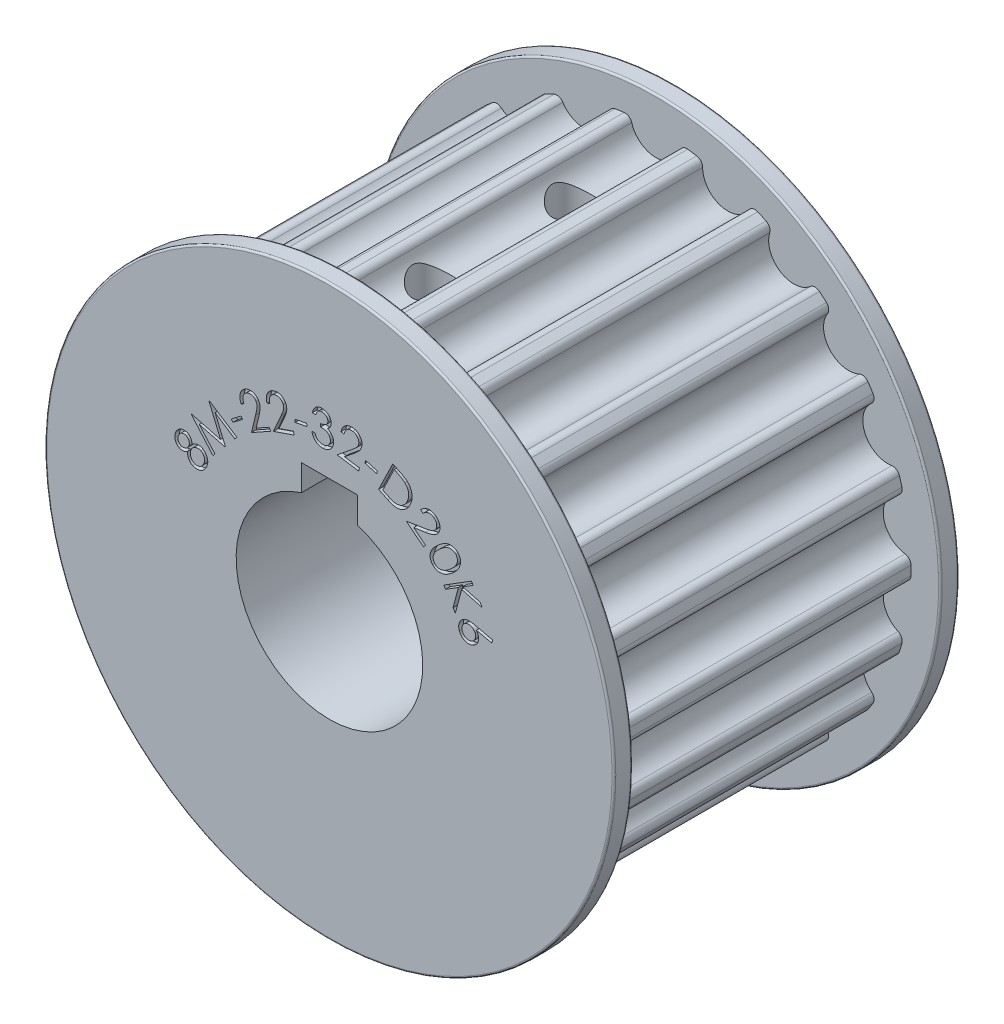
SolidWorks part; units mm, degrees
other "M5 Tapped Hole1[1]"
ref_plane "Front Plane" through (0, 0, 0) normal (0, 0, 1) x (1, 0, 0)
ref_plane "Top Plane" through (0, 0, 0) normal (0, 1, 0) x (1, 0, 0)
ref_plane "Right Plane" through (0, 0, 0) normal (1, 0, 0) x (0, 0, -1)
imported_body "Imported1"
sketch "Sketch1" plane through (0, 0, 37.5) normal (0, 0, 1) x (1, 0, 0)
  circle A0 centre (0, 0) radius 30.5
extrude "Cut-Extrude1" cut sketch "Sketch1" against normal blind 1.5
sketch "Sketch2" plane through (0, 0, -2.5) normal (0, 0, -1) x (-1, 0, 0)
  circle A0 centre (0, 0) radius 30.5
extrude "Cut-Extrude2" cut sketch "Sketch2" against normal blind 1.5
sketch "Sketch3" plane through (0, 0, 36) normal (0, 0, 1) x (1, 0, 0)
  line L0 (3, 12.3394) -> (3, 9.5394)
  line L1 (3, 12.3394) -> (-3, 12.3394)
  line L2 (-3, 12.3394) -> (-3, 9.5394)
  circle A0 centre (0, 0) radius 30.5
  arc A1 (-3, 9.5394) -> (3, 9.5394) centre (0, 0) ccw
extrude "Boss-Extrude1" add sketch "Sketch3" against normal blind 2
sketch "Sketch4" plane through (0, 0, -1) normal (0, 0, -1) x (-1, 0, 0)
  line L0 (3, 12.3394) -> (3, 9.5394)
  line L1 (3, 12.3394) -> (-3, 12.3394)
  line L2 (-3, 12.3394) -> (-3, 9.5394)
  circle A0 centre (0, 0) radius 30.5
  arc A1 (-3, 9.5394) -> (3, 9.5394) centre (0, 0) ccw
extrude "Boss-Extrude2" add sketch "Sketch4" against normal blind 2
sketch "Sketch5" plane through (0, 0, 36) normal (0, 0, 1) x (1, 0, 0)
  circle A0 centre (0, 0) radius 15 construction
  text T0 "8M-22-32-D20K6   "
extrude "Cut-Extrude4" cut sketch "Sketch5" against normal blind 0.5
fillet "Fillet1" radius 0.2 4 edges at (-30.5, 0, -1) (-30.5, 0, 1) (30.5, 0, 34) (30.5, 0, 36)
